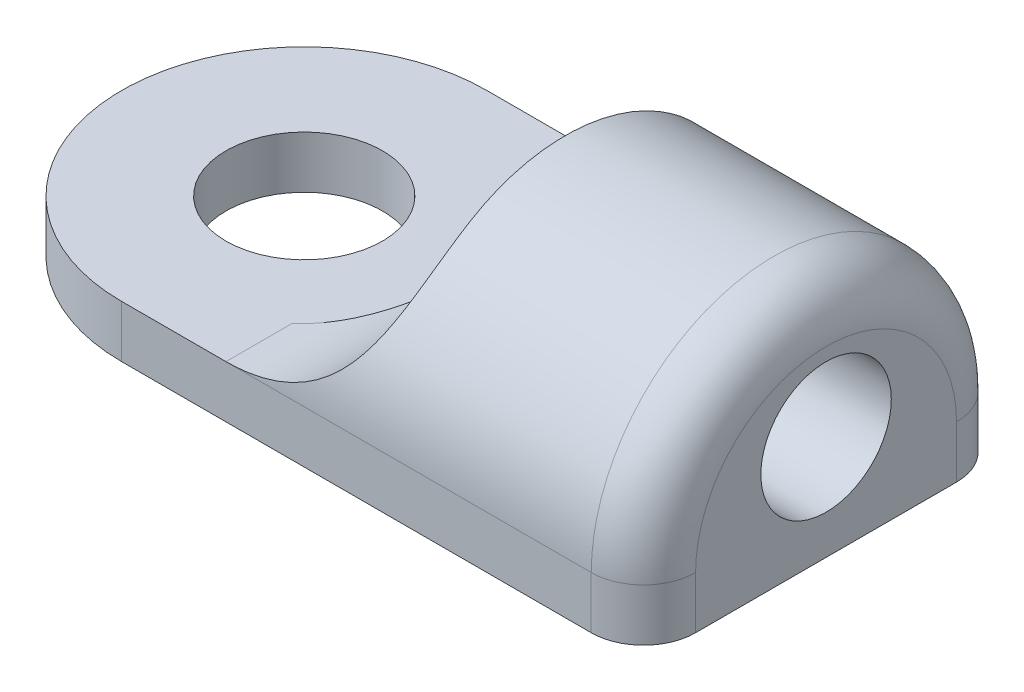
SolidWorks part; units mm, degrees
ref_plane "Front" through (0, 0, 0) normal (0, 0, 1) x (1, 0, 0)
ref_plane "Top" through (0, 0, 0) normal (0, 1, 0) x (1, 0, 0)
ref_plane "Right" through (0, 0, 0) normal (1, 0, 0) x (0, 0, -1)
sketch "Esquisse1" plane through (0, 0, 0) normal (0, 1, 0) x (1, 0, 0)
  line L0 (0, 0) -> (10, 0) construction
  line L1 (0, 3.5) -> (10, 3.5)
  line L2 (0, -3.5) -> (10, -3.5)
  line L3 (10, 3.5) -> (10, -3.5)
  arc A0 (0, 3.5) -> (0, -3.5) centre (0, 0) ccw
  circle A2 centre (0, 0) radius 1.5
  point P3 (5, 0)
  dimension "D3" = 3
  dimension "D1" = 7
  dimension "D2" = 10
extrude "Boss.-Extru.1" add sketch "Esquisse1" along normal blind 1
sketch "Esquisse2" plane through (10, 0, 0) normal (1, 0, 0) x (0, 0, -1)
  line L0 (-3.5, 1) -> (3.5, 1) construction
  line L1 (-3.5, 1) -> (3.5, 1)
  arc A0 (3.5, 1) -> (-3.5, 1) centre (0, 1) ccw
extrude "Boss.-Extru.2" add sketch "Esquisse2" against normal blind 5
fillet "Congé1" radius 3 1 edges at (5, 1, 0)
sketch "Esquisse3" plane through (0, 1, 0) normal (0, 1, 0) x (1, 0, 0)
  circle A0 centre (0, 0) radius 3
  dimension "D1" = 6
extrude "Enlèv. mat.-Extru.1" cut sketch "Esquisse3" along normal blind 5 draft 20
sketch "Esquisse4" plane through (10, 0, 0) normal (1, 0, 0) x (0, 0, -1)
  line L0 (0, 0) -> (0, 2) construction
  line L1 (-3.5, 0) -> (3.5, 0) construction
  circle A0 centre (0, 2) radius 1.25
  dimension "D2" = 2.5
  dimension "D1" = 2
extrude "Enlèv. mat.-Extru.2" cut sketch "Esquisse4" against normal blind 3
fillet "Congé2" radius 1 3 edges at (10, 0.5, -3.5) (10, 0.5, 3.5) (10, 4.5, 0)
